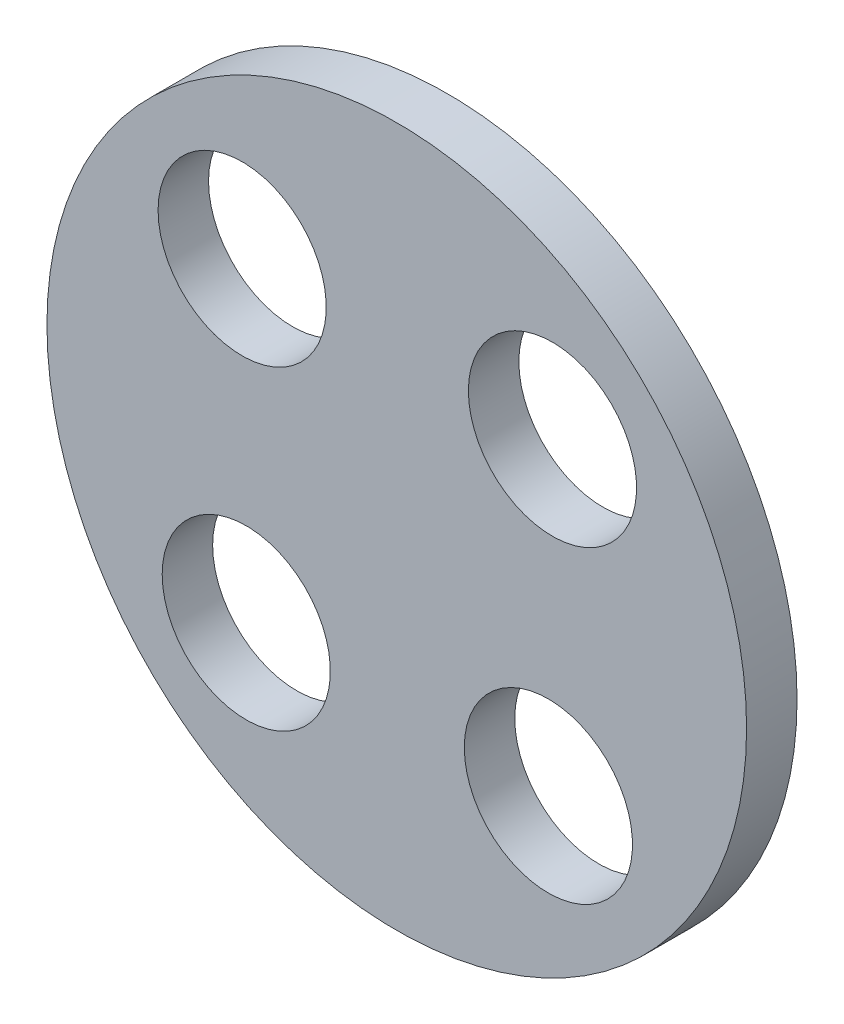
SolidWorks part; units mm, degrees
ref_plane "Front Plane" through (0, 0, 0) normal (0, 0, 1) x (1, 0, 0)
ref_plane "Top Plane" through (0, 0, 0) normal (0, 1, 0) x (1, 0, 0)
ref_plane "Right Plane" through (0, 0, 0) normal (1, 0, 0) x (0, 0, -1)
sketch "Sketch1" plane through (0, 0, 0) normal (0, 0, 1) x (1, 0, 0)
  circle A0 centre (0, 0) radius 26.416
  dimension "D1" = 52.832
extrude "Extrude1" add sketch "Sketch1" along normal blind 3.81
sketch "Sketch2" plane through (0, 0, 0) normal (0, 0, 1) x (1, 0, 0)
  line L0 (0, 0) -> (0, 27.8395) construction
  line L1 (0, 0) -> (0, -28.8472) construction
  line L2 (0, 0) -> (-23.3487, 23.3487) construction
  line L3 (0, 0) -> (-29.645, 0) construction
  line L4 (0, 0) -> (31.2407, 0) construction
  circle A0 centre (-11.6743, 11.6743) radius 6.35
  circle A1 centre (11.7569, 11.5912) radius 6.35
  circle A2 centre (11.4489, -11.8955) radius 6.35
  circle A3 centre (-11.3643, -11.9764) radius 6.35
  dimension "D2" = 12.7
  dimension "D4" = 12.7
  dimension "D5" = 12.7
  dimension "D6" = 12.7
  dimension "D1" = 45
  dimension "D3" = 16.51
  dimension "D7" = 16.51
  dimension "D8" = 16.51
  dimension "D9" = 16.51
extrude "Cut-Extrude1" cut sketch "Sketch2" along normal through all
